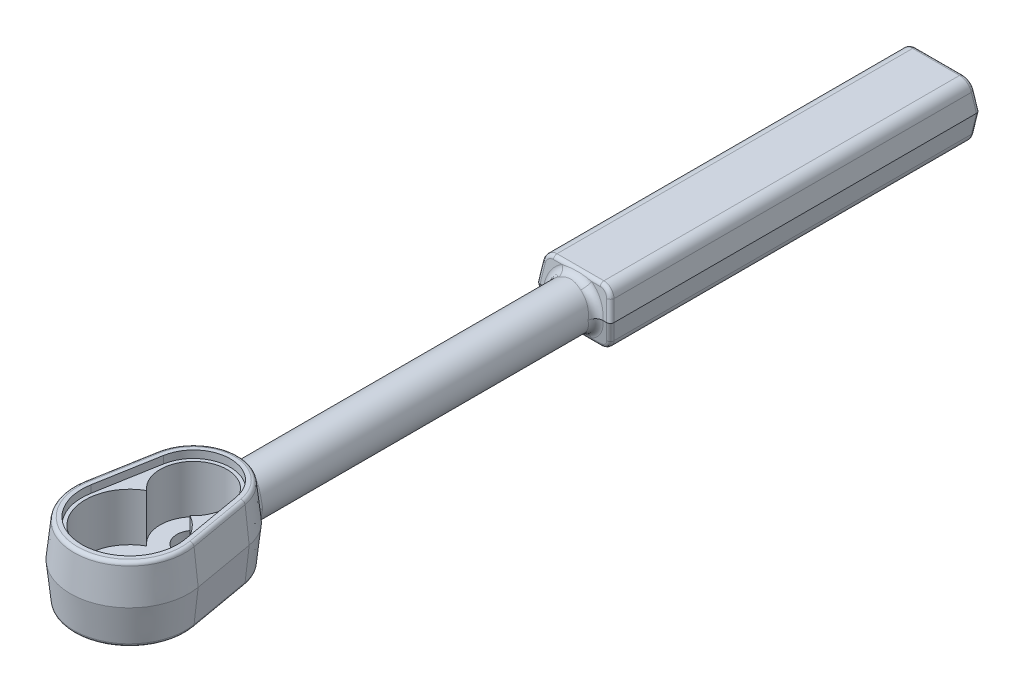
SolidWorks part; units mm, degrees
ref_plane "Front Plane" through (0, 0, 0) normal (0, 0, 1) x (1, 0, 0)
ref_plane "Top Plane" through (0, 0, 0) normal (0, 1, 0) x (1, 0, 0)
ref_plane "Right Plane" through (0, 0, 0) normal (1, 0, 0) x (0, 0, -1)
sketch "Sketch1" plane through (0, 0, 0) normal (0, 1, 0) x (1, 0, 0)
  line L0 (0, 0) -> (0, 220) construction
  line L1 (-10, 220) -> (10, 220)
  line L2 (10, 220) -> (10, 120)
  line L3 (-10, 220) -> (-10, 120)
  line L4 (10, 120) -> (0, 120)
  line L5 (-10, 120) -> (0, 120)
  dimension "D1" = 10
  dimension "D2" = 120
  dimension "D3" = 220
extrude "Handle" add sketch "Sketch1" along normal mid plane 15 draft 8
sketch "Sketch2" plane through (0, 0, 0) normal (0, 0, 1) x (1, 0, 0)
  circle A0 centre (0, 0) radius 6
  dimension "D1" = 12
extrude "Transition" add sketch "Sketch2" against normal up to next
sketch "Sketch3" plane through (0, 0, 0) normal (0, 1, 0) x (1, 0, 0)
  line L0 (0, 0) -> (0, 17.2763) construction
  line L1 (-12.8025, 19.5337) -> (-15.7569, 2.7784)
  line L2 (12.8025, 19.5337) -> (15.7569, 2.7784)
  arc A0 (15.7569, 2.7784) -> (-15.7569, 2.7784) centre (0, 0) cw
  arc A1 (-12.8025, 19.5337) -> (12.8025, 19.5337) centre (0, 17.2763) cw
  point P6 (-83.0935, 90.1057)
  point P8 (-86.6918, 73.3136)
  dimension "D1" = 13
  dimension "D2" = 16
  dimension "D4" = 20
extrude "Head" add sketch "Sketch3" along normal mid plane 20 draft 6
sketch "Sketch4" plane through (0, 10, 0) normal (0, 1, 0) x (-1, 0, 0)
  line L4 (9.7978, -19.0039) -> (12.7522, -2.2486)
  line L5 (-12.7522, -2.2486) -> (-9.7978, -19.0039)
  line L6 (9.7978, -19.0039) -> (12.7522, -2.2486)
  line L7 (-12.7522, -2.2486) -> (-9.7978, -19.0039)
  arc A4 (-9.7978, -19.0039) -> (9.7978, -19.0039) centre (0, -17.2763) ccw
  arc A5 (12.7522, -2.2486) -> (-12.7522, -2.2486) centre (0, 0) ccw
  arc A6 (-9.7978, -19.0039) -> (9.7978, -19.0039) centre (0, -17.2763) ccw
  arc A7 (12.7522, -2.2486) -> (-12.7522, -2.2486) centre (0, 0) ccw
  dimension "D1" = 2
extrude "Recess" cut sketch "Sketch4" against normal blind 2
sketch "Sketch5" plane through (0, 8, 0) normal (0, 1, 0) x (-1, 0, 0)
  arc A0 (-5.8786, -10.4615) -> (5.8786, -10.4615) centre (0, -17.2763) ccw
  arc A1 (5.8786, -10.4615) -> (-5.8786, -10.4615) centre (0, 0) ccw
  arc A2 (12.7522, -2.2486) -> (-12.7522, -2.2486) centre (0, 0) ccw construction
  dimension "D1" = 18
  dimension "D2" = 24
extrude "Pocket" cut sketch "Sketch5" against normal offset from surface (13 mm away) 5
sketch "Sketch6" plane through (0, -5, 0) normal (0, 1, 0) x (-1, 0, 0)
  circle A0 centre (0, -17.2763) radius 4.5
  dimension "D1" = 9
extrude "Wheel Hole" cut sketch "Sketch6" against normal through all
sketch "Sketch7" plane through (-4.6514, -5, 19.111) normal (0, 1, 0) x (-1, 0, 0)
  circle A0 centre (-4.6514, -19.111) radius 6
  arc A1 (1.2272, -29.5724) -> (-10.53, -29.5724) centre (-4.6514, -19.111) ccw construction
  dimension "D1" = 6
extrude "Ratchet Hole" cut sketch "Sketch7" against normal through all
fillet "Handle Fillets" radius 3 4 edges at (8.9459, 7.5, -170) (-8.9459, -7.5, -170) (8.9459, -7.5, -170) (-8.9459, 7.5, -170)
fillet "H End Fillets" radius 1 28 edges at (-8.3063, 6.7641, -120.9506) (8.3063, 6.7641, -120.9506) (0, 10, -29.2253) (-13.2446, 10, -10.9735) (0, 10, 14.949) (13.2446, 10, -10.9735) (0, -10, -29.2253) (13.2446, -10, -10.9735) (0, -10, 14.949) (-13.2446, -10, -10.9735) (-9.6544, -2.4588, -219.6544) (-9.6544, -2.4588, -120.3456) (0, -7.5, -121.0541) (9.6544, -2.4588, -120.3456) (8.3063, -6.7641, -120.9506) (-8.3063, -6.7641, -120.9506) (0, -7.5, -218.9459) (9.6544, -2.4588, -219.6544) (8.3063, -6.7641, -219.0494) (-8.3063, -6.7641, -219.0494) (0, 7.5, -121.0541) (0, 7.5, -218.9459) (-9.6544, 2.4588, -219.6544) (9.6544, 2.4588, -219.6544) (-8.3063, 6.7641, -219.0494) (8.3063, 6.7641, -219.0494) (9.6544, 2.4588, -120.3456) (-9.6544, 2.4588, -120.3456)
fillet "T-H Fillets" radius 2 4 edges at (0.2191, 5.996, -29.6442) (0.2191, -5.996, -29.6442) (0, 6, -120.8432) (0, -6, -120.8432)
